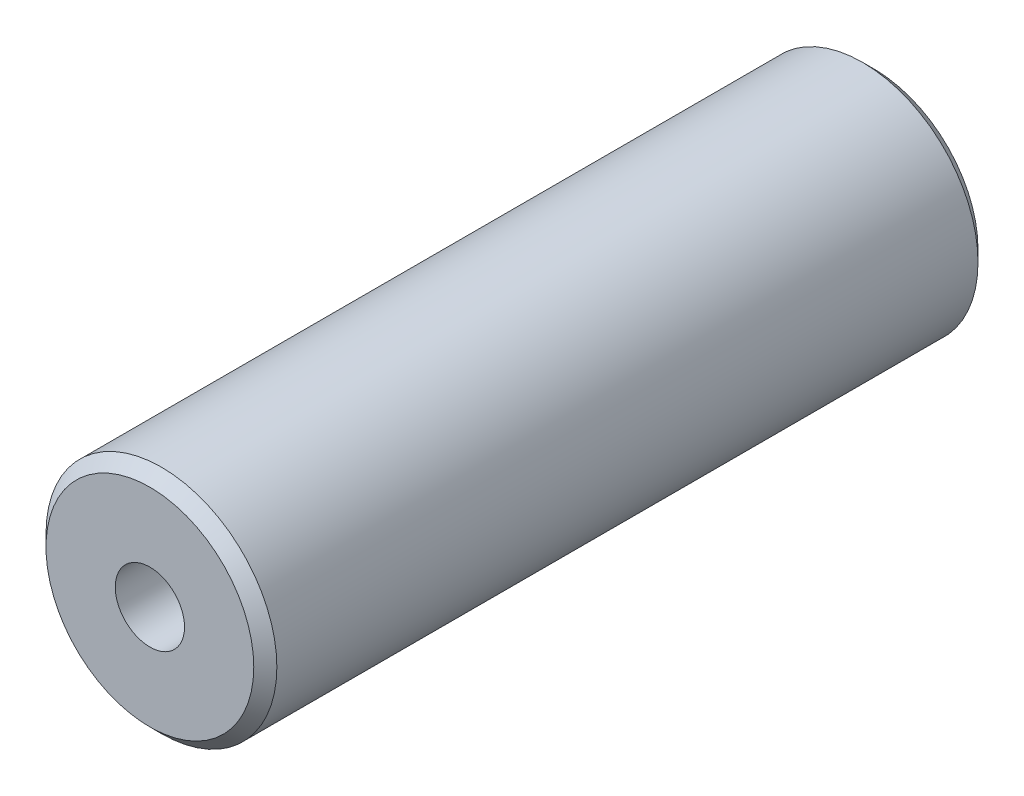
SolidWorks part; units mm, degrees
ref_plane "前视基准面" through (0, 0, 0) normal (0, 0, 1) x (1, 0, 0)
ref_plane "上视基准面" through (0, 0, 0) normal (0, 1, 0) x (1, 0, 0)
ref_plane "右视基准面" through (0, 0, 0) normal (1, 0, 0) x (0, 0, -1)
sketch "草图1" plane through (0, 0, 0) normal (0, 0, 1) x (1, 0, 0)
  circle A0 centre (0, 0) radius 10
extrude "凸台-拉伸1" add sketch "草图1" along normal blind 62.74
chamfer "倒角1" distance 1 angle 45 2 edges at (10, 0, 0) (10, 0, 62.74)
sketch "草图2" plane through (0, 0, 62.74) normal (0, 0, 1) x (1, 0, 0)
  circle A0 centre (0, 0) radius 3
extrude "切除-拉伸1" cut sketch "草图2" against normal blind 10
sketch "草图3" plane through (0, 0, 0) normal (0, 0, -1) x (-1, 0, 0)
  circle A0 centre (0, 0) radius 3
extrude "切除-拉伸2" cut sketch "草图3" against normal blind 10
